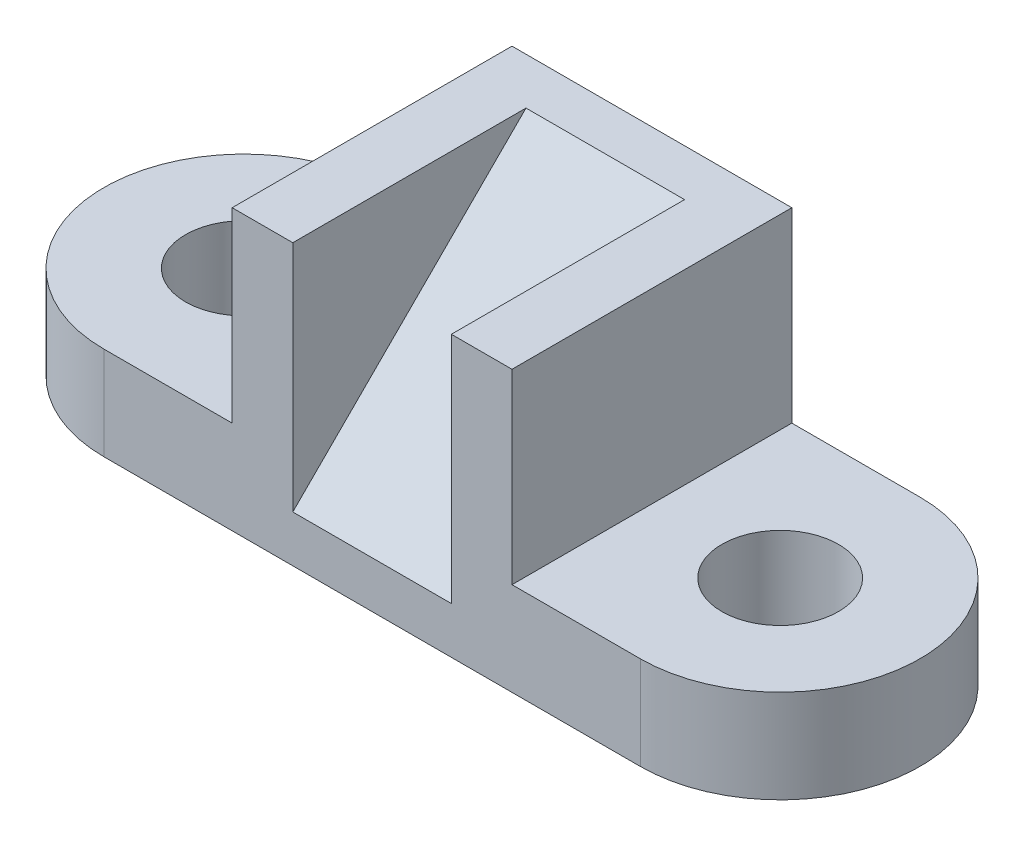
SolidWorks part; units mm, degrees
ref_plane "Front Plane" through (0, 0, 0) normal (0, 0, 1) x (1, 0, 0)
ref_plane "Top Plane" through (0, 0, 0) normal (0, 1, 0) x (1, 0, 0)
ref_plane "Right Plane" through (0, 0, 0) normal (1, 0, 0) x (0, 0, -1)
sketch "Sketch1" plane through (0, 0, 0) normal (0, 1, 0) x (1, 0, 0)
  line L0 (0, 0) -> (-57.5, 0) construction
  line L1 (0, 0) -> (0, 62.3115) construction
  line L2 (0, -30) -> (-57.5, -30)
  line L3 (-57.5, 30) -> (0, 30)
  line L4 (0, 30) -> (0, -30)
  circle A0 centre (-57.5, 0) radius 12.5
  arc A1 (-57.5, -30) -> (-57.5, 30) centre (-57.5, 0) cw
  dimension "D1" = 115
  dimension "D3" = 30
  dimension "D2" = 25
extrude "Extrude1" add sketch "Sketch1" along normal blind 20
sketch "Sketch4" plane through (0, 20, 0) normal (0, 1, 0) x (-1, 0, 0)
  line L0 (0, -30) -> (30, -30)
  line L1 (0, -30) -> (57.5, -30) construction
  line L2 (30, -30) -> (30, 30)
  line L3 (57.5, 30) -> (0, 30) construction
  line L4 (30, 30) -> (0, 30)
  line L5 (0, -30) -> (0, 30)
  dimension "D1" = 30
extrude "Extrude2" add sketch "Sketch4" along normal blind 40
sketch "Sketch5" plane through (0, 0, 0) normal (1, 0, 0) x (0, 0, -1)
  line L0 (-30, 10) -> (20, 60)
  line L1 (-30, 60) -> (-30, 0) construction
  line L2 (-30, 60) -> (30, 60) construction
  line L3 (20, 60) -> (-30, 60)
  line L4 (-30, 60) -> (-30, 10)
  dimension "D1" = 10
  dimension "D2" = 10
extrude "Cut-Extrude1" cut sketch "Sketch5" against normal blind 17
mirror "Mirror1" about plane through (0, 20, -30) normal (-1, 0, 0)
